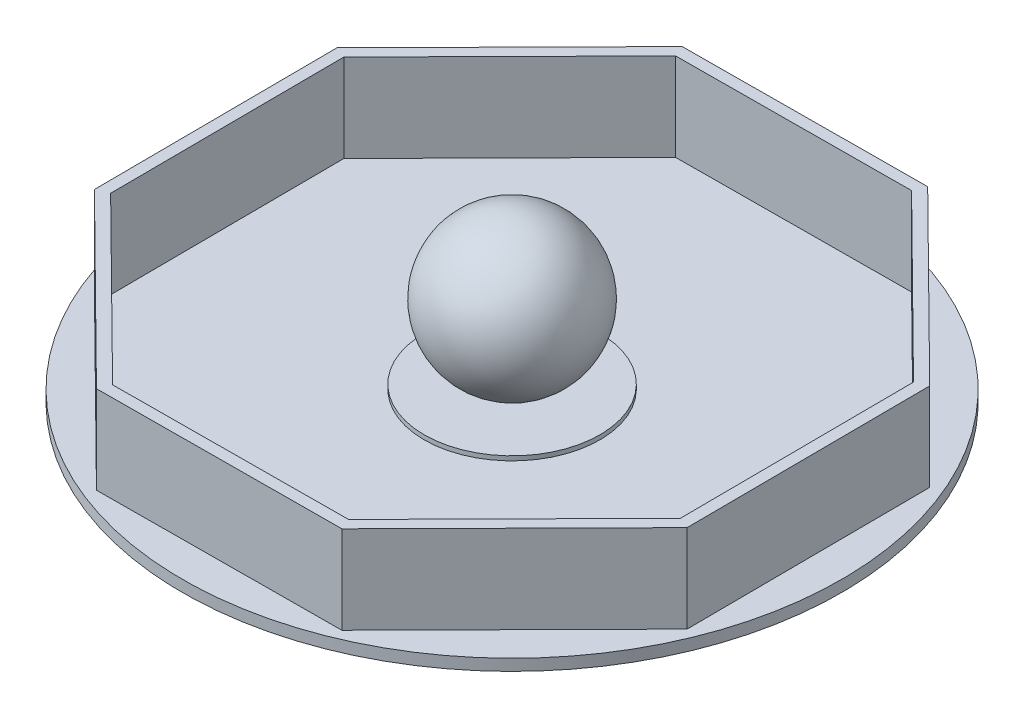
SolidWorks part; units mm, degrees
ref_plane "Front Plane" through (0, 0, 0) normal (0, 0, 1) x (1, 0, 0)
ref_plane "Top Plane" through (0, 0, 0) normal (0, 1, 0) x (1, 0, 0)
ref_plane "Right Plane" through (0, 0, 0) normal (1, 0, 0) x (0, 0, -1)
sketch "Sketch1" plane through (0, 0, 0) normal (0, 1, 0) x (1, 0, 0)
  circle A0 centre (0, 0) radius 95.25
  circle A1 centre (0, 0) radius 3.175
  dimension "D1" = 190.5
  dimension "D2" = 6.35
extrude "Boss-Extrude1" add sketch "Sketch1" along normal blind 3.302
ref_plane "Plane1" through (0, 3.302, 0) normal (0, 1, 0) x (1, 0, 0)
sketch "Sketch2" plane through (0, 3.302, 0) normal (0, 1, 0) x (1, 0, 0)
  line L9 (33.4181, 82.0393) -> (-34.3804, 81.6407)
  line L10 (85.3493, -34.7664) -> (84.9346, 35.7675)
  line L11 (84.9346, 35.7675) -> (34.7664, 85.3493)
  line L12 (34.7664, 85.3493) -> (-35.7675, 84.9346)
  line L13 (-35.7675, 84.9346) -> (-85.3493, 34.7664)
  line L14 (-85.3493, 34.7664) -> (-84.9346, -35.7675)
  line L15 (-84.9346, -35.7675) -> (-34.7664, -85.3493)
  line L16 (-34.7664, -85.3493) -> (35.7675, -84.9346)
  line L17 (35.7675, -84.9346) -> (85.3493, -34.7664)
  line L18 (-34.3804, 81.6407) -> (-82.0393, 33.4181)
  line L19 (-82.0393, 33.4181) -> (-81.6407, -34.3804)
  line L20 (-81.6407, -34.3804) -> (-33.4181, -82.0393)
  line L21 (-33.4181, -82.0393) -> (34.3804, -81.6407)
  line L22 (34.3804, -81.6407) -> (82.0393, -33.4181)
  line L23 (82.0393, -33.4181) -> (81.6407, 34.3804)
  line L24 (81.6407, 34.3804) -> (33.4181, 82.0393)
  circle A0 centre (0, 0) radius 85.1434 construction
  dimension "D1" = 3.302
extrude "Boss-Extrude2" add sketch "Sketch2" along normal blind 25.4
ref_plane "Plane2" through (0, 3.302, 0) normal (0, 1, 0) x (1, 0, 0)
sketch "Sketch3" plane through (0, 3.302, 0) normal (0, 1, 0) x (1, 0, 0)
  circle A0 centre (0, 0) radius 25.4
  circle A1 centre (0, 0) radius 3.175
  dimension "D1" = 50.8
  dimension "D2" = 6.35
extrude "Boss-Extrude3" add sketch "Sketch3" along normal blind 1.27
ref_plane "Plane3" through (0, 25.908, 0) normal (0, 1, 0) x (1, 0, 0)
sketch "Sketch4" plane through (0, 25.908, 0) normal (0, 1, 0) x (1, 0, 0)
  line L0 (-21.336, 0) -> (21.336, 0)
  arc A2 (-21.336, 0) -> (21.336, 0) centre (0, 0) cw
  dimension "D1" = 21.336
revolve "Revolve2" add sketch "Sketch4" angle 360 about L0
